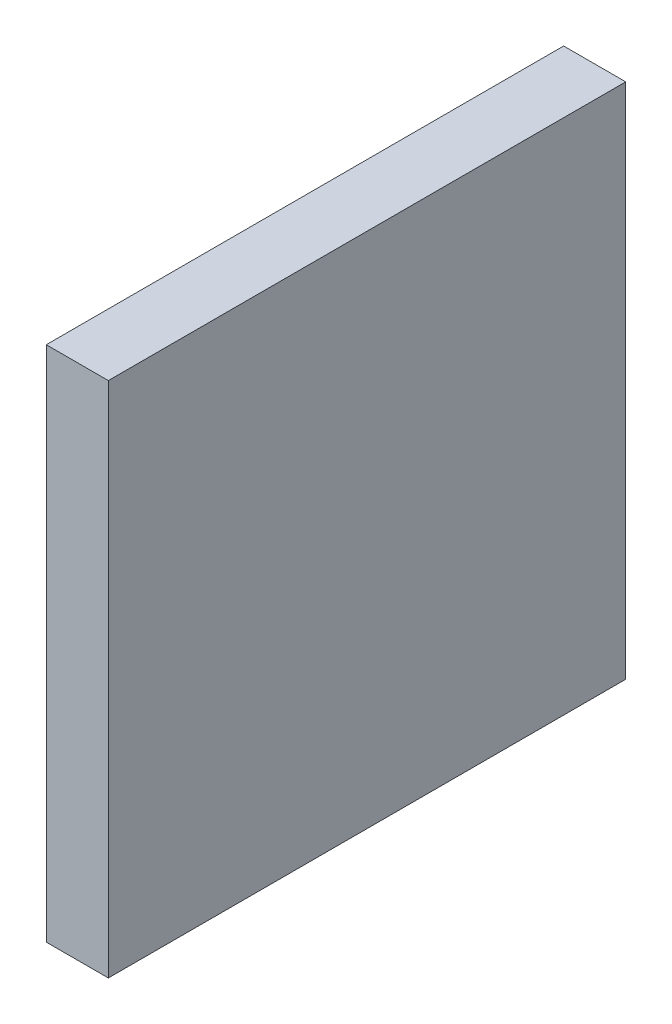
SolidWorks part; units mm, degrees
ref_plane "Front Plane" through (0, 0, 0) normal (0, 0, 1) x (1, 0, 0)
ref_plane "Top Plane" through (0, 0, 0) normal (0, 1, 0) x (1, 0, 0)
ref_plane "Right Plane" through (0, 0, 0) normal (1, 0, 0) x (0, 0, -1)
sketch "Sketch1" plane through (0, 0, 0) normal (1, 0, 0) x (0, 0, -1)
  line L1 (0, 0) -> (50, 0)
  line L2 (0, 0) -> (0, 50)
  line L3 (0, 50) -> (50, 50)
  line L4 (50, 0) -> (50, 50)
  dimension "D1" = 50
  dimension "D2" = 50
extrude "Extrude1" add sketch "Sketch1" along normal blind 6
